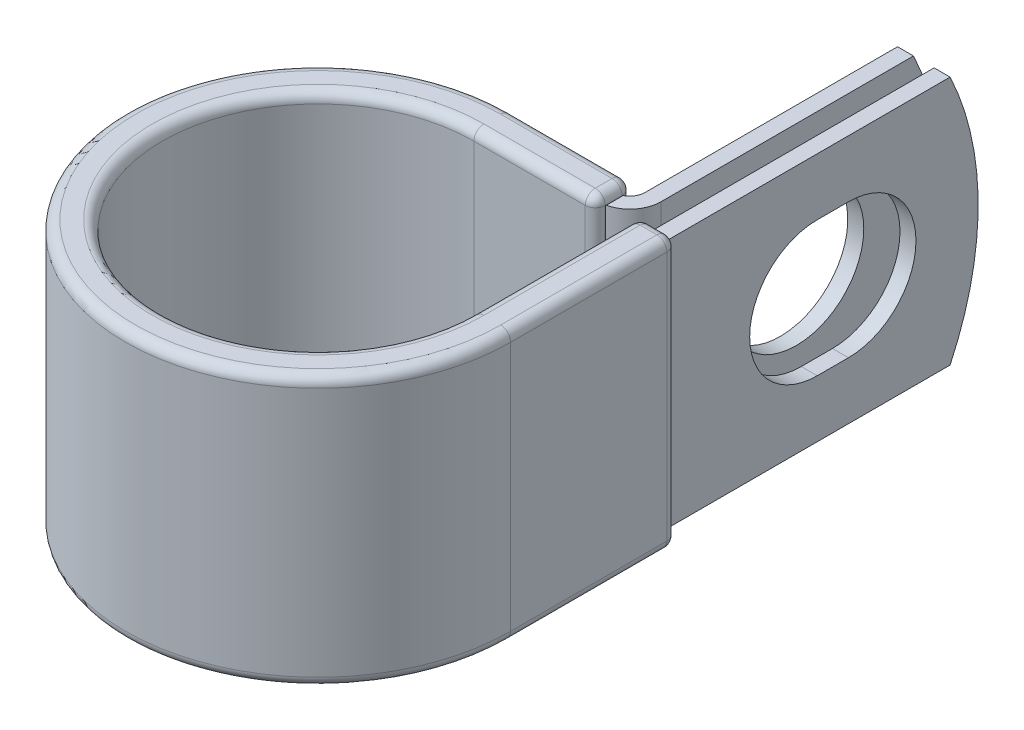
SolidWorks part; units mm, degrees
ref_plane "Front Plane" through (0, 0, 0) normal (0, 0, 1) x (1, 0, 0)
ref_plane "Top Plane" through (0, 0, 0) normal (0, 1, 0) x (1, 0, 0)
ref_plane "Right Plane" through (0, 0, 0) normal (1, 0, 0) x (0, 0, -1)
sketch "Sketch1" plane through (0, 0, 0) normal (0, 1, 0) x (1, 0, 0)
  line L0 (0, 12.6937) -> (8.7414, 12.6937)
  line L1 (12.6937, 0) -> (12.6937, 12.6937)
  line L2 (11.1189, 36.4998) -> (11.1189, 15.0711)
  line L5 (12.6937, 12.6937) -> (12.6937, 36.4998)
  arc A0 (0, 12.6937) -> (12.6937, 0) centre (0, 0) ccw
  arc A3 (8.7414, 12.6937) -> (11.1189, 15.0711) centre (8.7414, 15.0711) ccw
extrude "Extrude-Thin1" add sketch "Sketch1" along normal mid plane 19.05 thin
sketch "Sketch2" plane through (9.8997, 0, 0) normal (-1, 0, 0) x (0, 0, 1)
  line L0 (-36.4998, 9.525) -> (-36.4998, -9.525) construction
  line L7 (0, 9.525) -> (0, -9.525) construction
  circle A0 centre (-25.4, 0) radius 5.1562
  point P2 (-36.4998, 0)
extrude "Cut-Extrude1" cut sketch "Sketch2" against normal up to surface (1.2192 mm away)
sketch "Sketch3" plane through (13.9129, 0, 0) normal (1, 0, 0) x (0, 0, -1)
  line L0 (24.2062, 0) -> (26.5938, 0) construction
  line L1 (24.2062, 5.1562) -> (26.5938, 5.1562)
  line L2 (24.2062, -5.1562) -> (26.5938, -5.1562)
  line L3 (36.4998, 9.525) -> (36.4998, -9.525) construction
  arc A0 (24.2062, 5.1562) -> (24.2062, -5.1562) centre (24.2062, 0) ccw
  arc A1 (26.5938, -5.1562) -> (26.5938, 5.1562) centre (26.5938, 0) ccw
  point P3 (25.4, 0)
  point P8 (36.4998, 0)
  point P11 (19.05, 0)
  point P12 (31.75, 0)
extrude "Cut-Extrude2" cut sketch "Sketch3" against normal up to surface (1.2192 mm away)
sketch "Sketch4" plane through (9.8997, 0, 0) normal (-1, 0, 0) x (0, 0, 1)
  line L0 (-36.4998, 9.525) -> (-36.4998, -9.525)
  line L1 (-36.4998, 9.525) -> (-34.3553, 9.525)
  line L2 (-36.4998, 9.525) -> (-15.0711, 9.525) construction
  line L3 (-36.4998, -9.525) -> (-34.3553, -9.525)
  line L4 (-36.4998, -9.525) -> (-15.0711, -9.525) construction
  arc A0 (-34.3553, 9.525) -> (-34.3553, -9.525) centre (-14.2748, 0) ccw
extrude "Cut-Extrude3" cut sketch "Sketch4" against normal through all contours A0 M4 M5 | A0 L0 M2
ref_plane "Plane1" through (0, 0, -12.6937) normal (0, 0, 1) x (1, 0, 0)
ref_plane "Plane2" through (0, 0, 0) normal (-1, 0, 0) x (0, 0, 1)
sketch "Sketch5" plane through (0, 0, -12.6937) normal (0, 0, 1) x (1, 0, 0)
  line L0 (12.6937, 9.525) -> (13.9129, 9.525)
  line L1 (12.6937, -9.525) -> (12.6937, 9.525)
  line L2 (11.8999, -9.5567) -> (11.8999, 9.5567)
  line L3 (13.9129, 9.525) -> (13.9129, -9.525)
  line L4 (13.9129, -9.525) -> (12.6937, -9.525)
  line L5 (12.6619, 10.3187) -> (13.9446, 10.3188)
  line L7 (14.7066, 9.5567) -> (14.7066, -9.5567)
  line L8 (13.9446, -10.3187) -> (12.6619, -10.3187)
  line L9 (11.8999, -10.3187) -> (11.8999, 10.3187) construction
  line L11 (14.7066, -10.3187) -> (11.8999, -10.3187) construction
  line L12 (14.7066, 10.3187) -> (14.7066, -10.3187) construction
  line L13 (11.8999, 10.3187) -> (14.7066, 10.3187) construction
  arc A0 (11.8999, -9.5567) -> (12.6619, -10.3187) centre (12.6619, -9.5567) ccw
  arc A1 (14.7066, -9.5567) -> (13.9446, -10.3187) centre (13.9446, -9.5567) cw
  arc A2 (11.8999, 9.5567) -> (12.6619, 10.3187) centre (12.6619, 9.5567) cw
  arc A3 (13.9446, 10.3188) -> (14.7066, 9.5567) centre (13.9446, 9.5567) cw
sketch "Sketch6" plane through (0, 9.525, 0) normal (0, 1, 0) x (1, 0, 0)
  line L0 (11.8999, 0) -> (11.8999, 12.6937)
  line L1 (0, 11.8999) -> (9.2647, 11.8999)
  line L2 (9.8997, 34.3553) -> (9.8997, 15.0711) construction
  arc A0 (0, 11.8999) -> (11.8999, 0) centre (0, 0) ccw
sweep "Sweep1" add profiles "Sketch5" path "Sketch6"
fillet "Fillet1" radius 0.762 16 edges at (9.2647, 10.0956, -14.4834) (9.2647, 0, -14.7066) (9.2647, -10.0956, -14.4834) (9.2647, -10.3187, -13.3032) (9.2647, -10.0956, -12.1231) (9.2647, 0, -11.8999) (9.2647, 10.0956, -12.1231) (14.4834, 10.0956, -12.6937) (14.7066, 0, -12.6937) (14.4834, -10.0956, -12.6937) (13.3033, -10.3187, -12.6937) (12.1231, -10.0956, -12.6937) (11.8999, 0, -12.6937) (12.1231, 10.0956, -12.6937) (9.2647, 10.3187, -13.3032) (13.3033, 10.3187, -12.6937)
equation "\"D4@Sketch5\" = \"D1@Extrude-Thin1\""
equation "\"D5@Sketch5\" = \"D5@Extrude-Thin1\""
equation "\"D1@Sketch3\" = \"D2@Sketch2\""
equation "\"D7@Sketch1\" = \"D3@Sketch2\" + \"D1@Sketch3\""
equation "\"D1@Sketch1\" = \"D1@Sketch6\" + 2 * \"D3@Sketch5\""
equation "\"D1@Sketch4\" = ( \"D1@Extrude-Thin1\" + .125 ) * 2"
equation "\"D2@Sketch1\"=1.95*\"D5@Extrude-Thin1\""
equation "\"D2@Sketch3\" = \"D1@Sketch2\""
